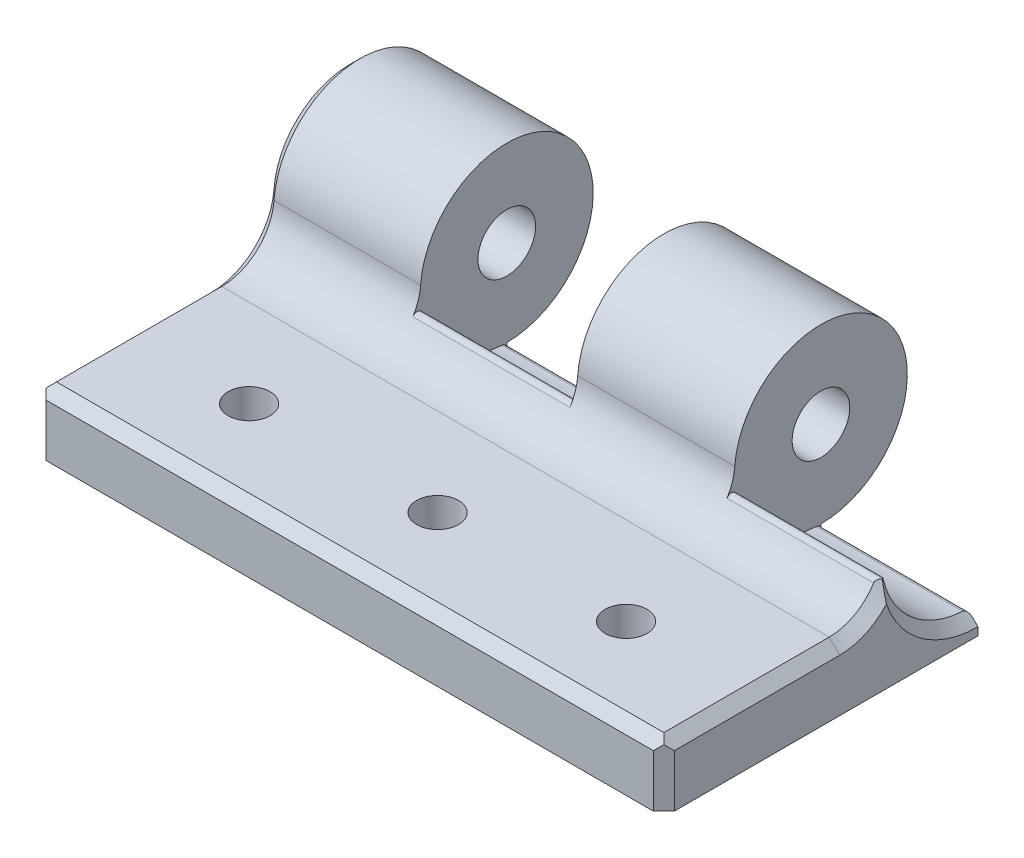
SolidWorks part; units mm, degrees
ref_plane "Front Plane" through (0, 0, 0) normal (0, 0, 1) x (1, 0, 0)
ref_plane "Top Plane" through (0, 0, 0) normal (0, 1, 0) x (1, 0, 0)
ref_plane "Right Plane" through (0, 0, 0) normal (1, 0, 0) x (0, 0, -1)
sketch "Sketch1" plane through (0, 0, 0) normal (1, 0, 0) x (0, 0, -1)
  line L0 (0, -8.25) -> (0, -10)
  line L1 (0, -10) -> (-30, -10)
  line L2 (-30, -10) -> (-30, -4)
  line L4 (-30, -4) -> (-3.2782, 7.5707) construction
  line L5 (-8.2265, 0.6226) -> (-8.2265, -4) construction
  line L7 (-30, -4) -> (-8.2265, -4) construction
  line L8 (-13.2122, -4) -> (-30, -4)
  circle A0 centre (0, 0) radius 2.75
  arc A1 (0, -8.25) -> (-8.2265, 0.6226) centre (0, 0) ccw
  arc A2 (-13.2122, -4) -> (-8.2265, 0.6226) centre (-13.2122, 1) ccw
extrude "Boss-Extrude1" add sketch "Sketch1" along normal mid plane 60
sketch "Sketch3" plane through (0, -4, 0) normal (0, 1, 0) x (1, 0, 0)
  line L0 (-30, -21.6061) -> (30, -21.6061) construction
  line L1 (-30, -13.2122) -> (-30, -30) construction
  line L2 (30, -13.2122) -> (30, -30) construction
  circle A0 centre (-18, -21.6061) radius 2
  circle A1 centre (0, -21.6061) radius 2
  circle A2 centre (18, -21.6061) radius 2
  dimension "D3" = 4
  dimension "D1" = 12
  dimension "D2" = 12
extrude "Cut-Extrude2" cut sketch "Sketch3" against normal blind 60
ref_plane "Plane1" through (-15, 0, 0) normal (-1, 0, 0) x (0, 0, 1)
chamfer "Chamfer1" distance 1 angle 45 7 edges at (30, 5.6092, -6.0498) (-30, -2.6665, 9.8127) (30, -2.6665, 9.8127) (-30, -4, 21.6061) (30, -4, 21.6061) (0, -4, 30) (-30, 5.6092, -6.0498)
sketch "Sketch4" plane through (-15, 0, 0) normal (-1, 0, 0) x (0, 0, 1)
  circle A0 centre (0, 0) radius 8.25
  arc A1 (8.2265, 0.6226) -> (0, -8.25) centre (0, 0) ccw construction
extrude "Cut-Extrude3" cut sketch "Sketch4" against normal blind 15
sketch "Sketch5" plane through (30, 0, 0) normal (1, 0, 0) x (0, 0, -1)
  circle A0 centre (0, 0) radius 8.25
  arc A1 (0, -8.25) -> (-8.2265, 0.6226) centre (0, 0) ccw construction
extrude "Cut-Extrude4" cut sketch "Sketch5" against normal blind 15
chamfer "Chamfer3" distance 1 angle 45 3 edges at (-30, -7.5, 30) (30, -7.5, 30) (30, -6.4977, 5.0835)
fillet "Fillet1" radius 0.5 2 edges at (-7.5, 0.6226, 8.2265) (22, 0.6226, 8.2265)
fillet "Fillet2" radius 0.5 2 edges at (22, -8.25, 0) (-7.5, -8.25, 0)
equation "\"D2@Sketch1\"=1.5*\"D1@Sketch1\""
